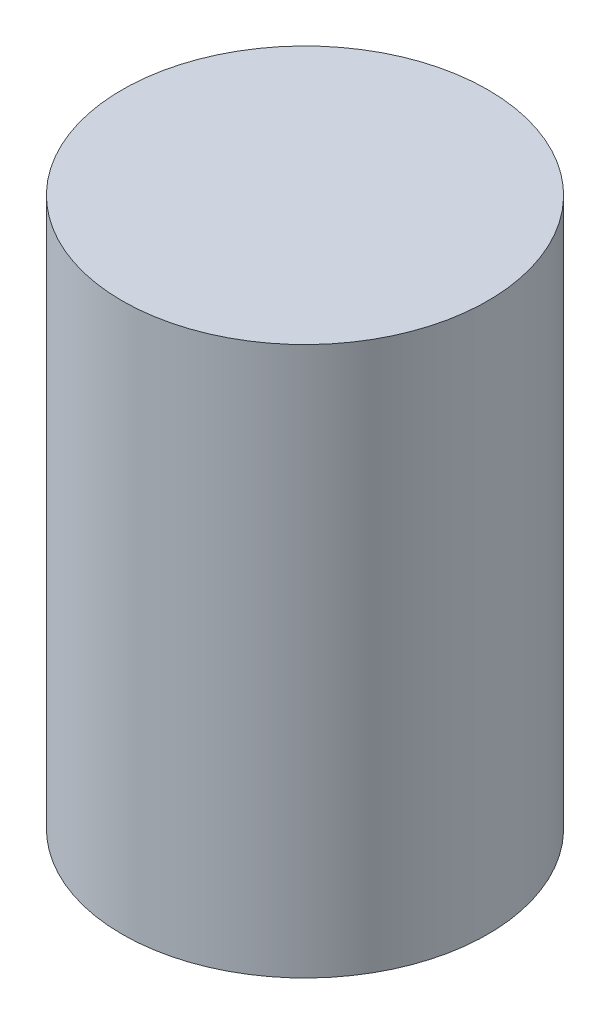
SolidWorks part; units mm, degrees
ref_plane "前视基准面" through (0, 0, 0) normal (0, 0, 1) x (1, 0, 0)
ref_plane "上视基准面" through (0, 0, 0) normal (0, 1, 0) x (1, 0, 0)
ref_plane "右视基准面" through (0, 0, 0) normal (1, 0, 0) x (0, 0, -1)
sketch "草图1" plane through (0, 0, 0) normal (0, 0, 1) x (1, 0, 0)
  line L0 (0, 100.4794) -> (0, 0) construction
  line L1 (0, 60) -> (-20, 60)
  line L2 (-20, 60) -> (-20, 0)
  line L3 (-20, 0) -> (0, 0)
  line L4 (0, 0) -> (0, 60)
  dimension "D1" = 20
  dimension "D2" = 60
revolve "旋转1" add sketch "草图1" angle 360 about L0
sketch "草图2" plane through (0, 0, 0) normal (0, 1, 0) x (1, 0, 0)
  circle A0 centre (0, 0) radius 20
  dimension "D1" = 40
curve "螺旋线/涡状线1"
